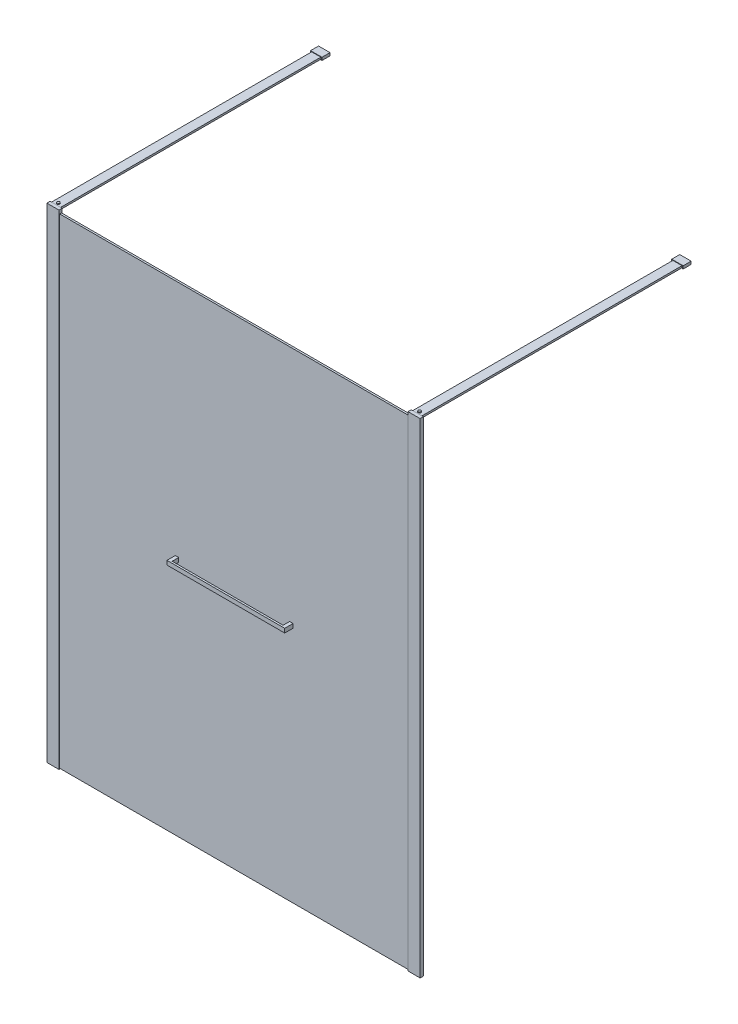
SolidWorks part; units mm, degrees
ref_plane "Płaszczyzna przednia" through (0, 0, 0) normal (0, 0, 1) x (1, 0, 0)
ref_plane "Płaszczyzna górna" through (0, 0, 0) normal (0, 1, 0) x (1, 0, 0)
ref_plane "Płaszczyzna prawa" through (0, 0, 0) normal (1, 0, 0) x (0, 0, -1)
sketch "Szkic1" plane through (0, 0, 0) normal (0, 1, 0) x (1, 0, 0)
  line L0 (0, 0) -> (0, 14)
  line L1 (0, 14) -> (53, 14)
  line L2 (53, 14) -> (53, 11)
  line L3 (53, 11) -> (42.9, 11)
  line L4 (42.9, 11) -> (42.9, 3)
  line L5 (42.9, 3) -> (53, 3)
  line L6 (53, 3) -> (53, 0)
  line L7 (53, 0) -> (0, 0)
  dimension "D1" = 53
  dimension "D2" = 14
  dimension "D3" = 10.1
  dimension "D5" = 8
extrude "Dodanie-wyciągnięcie1" add sketch "Szkic1" along normal blind 2100 from offset 3
sketch "Szkic2" plane through (0, 3, 0) normal (0, -1, 0) x (1, 0, 0)
  line L0 (42.9, -11) -> (53, -11) construction
  line L1 (42.9, -3) -> (1589.9, -3)
  line L2 (42.9, -3) -> (42.9, -11)
  line L3 (42.9, -11) -> (1589.9, -11)
  line L4 (1589.9, -3) -> (1589.9, -11)
  dimension "D1" = 1547
extrude "Dodanie-wyciągnięcie2" add sketch "Szkic2" against normal blind 2100 separate body
sketch "Szkic3" plane through (0, 3, 0) normal (0, -1, 0) x (1, 0, 0)
  line L0 (1579.8, -3) -> (1579.8, 0)
  line L1 (1589.9, -3) -> (42.9, -3) construction
  line L2 (1579.8, 0) -> (1632.8, 0)
  line L3 (1632.8, 0) -> (1632.8, -14)
  line L4 (1632.8, -14) -> (1579.8, -14)
  line L5 (1579.8, -14) -> (1579.8, -11)
  line L6 (1579.8, -11) -> (1589.9, -11)
  line L7 (1589.9, -11) -> (1589.9, -3)
  line L8 (1589.9, -3) -> (1579.8, -3)
  line L9 (42.9, -11) -> (1589.9, -11) construction
  line L10 (1589.9, -11) -> (1589.9, -3) construction
  dimension "D1" = 10.1
  dimension "D2" = 14
  dimension "D4" = 53
extrude "Dodanie-wyciągnięcie3" add sketch "Szkic3" against normal blind 2100 separate body
sketch "Szkic4" plane through (0, 2103, 0) normal (0, 1, 0) x (1, 0, 0)
  line L1 (0, 14) -> (53, 14)
  line L2 (0, 14) -> (0, 0)
  line L3 (0, 0) -> (53, 0)
  line L4 (53, 14) -> (53, 0)
extrude "Dodanie-wyciągnięcie4" add sketch "Szkic4" along normal blind 16
sketch "Szkic5" plane through (0, 2103, 0) normal (0, 1, 0) x (1, 0, 0)
  line L1 (1632.8, 14) -> (1579.8, 14)
  line L2 (1632.8, 14) -> (1632.8, 0)
  line L3 (1632.8, 0) -> (1579.8, 0)
  line L4 (1579.8, 14) -> (1579.8, 0)
extrude "Dodanie-wyciągnięcie5" add sketch "Szkic5" along normal blind 16
sketch "Szkic7" plane through (0, 3, 0) normal (0, -1, 0) x (1, 0, 0)
  line L1 (1579.8, 0) -> (1632.8, 0)
  line L2 (1579.8, 0) -> (1579.8, -14)
  line L3 (1579.8, -14) -> (1632.8, -14)
  line L4 (1632.8, 0) -> (1632.8, -14)
extrude "Dodanie-wyciągnięcie7" add sketch "Szkic7" along normal blind 3
sketch "Szkic8" plane through (0, 3, 0) normal (0, -1, 0) x (1, 0, 0)
  line L1 (0, 0) -> (53, 0)
  line L2 (0, 0) -> (0, -14)
  line L3 (0, -14) -> (53, -14)
  line L4 (53, 0) -> (53, -14)
extrude "Dodanie-wyciągnięcie8" add sketch "Szkic8" along normal blind 3
sketch "Szkic9" plane through (0, 0, -14) normal (0, 0, -1) x (-1, 0, 0)
  line L0 (-1632.8, 2119) -> (-1579.8, 2119) construction
  line L1 (-1626.3, 2119) -> (-1586.3, 2119)
  line L2 (-1626.3, 2119) -> (-1626.3, 2111)
  line L3 (-1626.3, 2111) -> (-1586.3, 2111)
  line L4 (-1586.3, 2119) -> (-1586.3, 2111)
  line L5 (-1632.8, 2119) -> (-1632.8, 0) construction
  line L6 (-1579.8, 2119) -> (-1579.8, 0) construction
  line L7 (-53, 2119) -> (-53, 0) construction
  line L8 (-46.5, 2119) -> (-6.5, 2119)
  line L9 (-46.5, 2119) -> (-46.5, 2111)
  line L10 (-46.5, 2111) -> (-6.5, 2111)
  line L11 (-6.5, 2119) -> (-6.5, 2111)
  line L12 (0, 2119) -> (0, 0) construction
  line L13 (-53, 2119) -> (0, 2119) construction
  dimension "D1" = 6.5
  dimension "D2" = 6.5
  dimension "D3" = 8
  dimension "D4" = 6.5
  dimension "D5" = 6.5
  dimension "D6" = 8
extrude "Dodanie-wyciągnięcie9" add sketch "Szkic9" along normal blind 1170 separate body
sketch "Szkic10" plane through (0, 0, -1184) normal (0, 0, -1) x (-1, 0, 0)
  line L0 (-1606.3, 2119) -> (-1606.3, 2115) construction
  line L1 (-1631.3, 2121.25) -> (-1581.3, 2121.25)
  line L2 (-1631.3, 2121.25) -> (-1631.3, 2108.75)
  line L3 (-1631.3, 2108.75) -> (-1581.3, 2108.75)
  line L4 (-1581.3, 2121.25) -> (-1581.3, 2108.75)
  line L5 (-1631.3, 2121.25) -> (-1581.3, 2108.75) construction
  line L6 (-1631.3, 2108.75) -> (-1581.3, 2121.25) construction
  line L7 (-1586.3, 2119) -> (-1626.3, 2119) construction
  line L8 (-1606.3, 2115) -> (-1626.3, 2115) construction
  line L9 (-1626.3, 2119) -> (-1626.3, 2111) construction
  line L10 (-26.5, 2119) -> (-26.5, 2115) construction
  line L11 (-51.5, 2121.25) -> (-1.5, 2121.25)
  line L12 (-51.5, 2121.25) -> (-51.5, 2108.75)
  line L13 (-51.5, 2108.75) -> (-1.5, 2108.75)
  line L14 (-1.5, 2121.25) -> (-1.5, 2108.75)
  line L15 (-51.5, 2121.25) -> (-1.5, 2108.75) construction
  line L16 (-51.5, 2108.75) -> (-1.5, 2121.25) construction
  line L17 (-6.5, 2119) -> (-46.5, 2119) construction
  line L18 (-26.5, 2115) -> (-46.5, 2115) construction
  line L19 (-46.5, 2119) -> (-46.5, 2111) construction
  point P0 (-1606.3, 2115)
  point P9 (-26.5, 2115)
  dimension "D1" = 12.5
  dimension "D2" = 50
  dimension "D3" = 12.5
  dimension "D4" = 50
extrude "Dodanie-wyciągnięcie10" add sketch "Szkic10" along normal blind 35 from offset 32
ref_plane "Płaszczyzna1" through (1606.3, 0, 0) normal (1, 0, 0) x (0, 0, -1)
sketch "Szkic11" plane through (1606.3, 0, 0) normal (1, 0, 0) x (0, 0, -1)
  line L0 (24, 2119) -> (24, 2127.4416) construction
  line L1 (24, 2119) -> (34.6926, 2119) construction
  line L2 (29.9, 2119) -> (29.65, 2122.8)
  line L3 (24, 2124.7) -> (30.2413, 2124.7) construction
  line L4 (24, 2124.7) -> (24, 2124.2)
  line L5 (1152, 2119) -> (14, 2119) construction
  line L6 (14, 2119) -> (14, 2111) construction
  line L7 (29.3989, 2119) -> (29.9, 2119)
  line L9 (29.1663, 2122.5357) -> (29.3989, 2119)
  arc A0 (24, 2124.7) -> (29.65, 2122.8) centre (24, 2115.3493) cw
  arc A1 (29.1663, 2122.5357) -> (24, 2124.2) centre (24, 2115.3493) ccw
  dimension "D1" = 0.5
  dimension "D2" = 11.3
  dimension "D3" = 5.7
  dimension "D4" = 3.8
  dimension "D5" = 11.8
  dimension "D6" = 0.5
  dimension "D7" = 10
revolve "Obrót1" add sketch "Szkic11" angle 360 about L0
ref_plane "Płaszczyzna2" through (26.5, 0, 0) normal (1, 0, 0) x (0, 0, -1)
sketch "Szkic14" plane through (26.5, 0, 0) normal (1, 0, 0) x (0, 0, -1)
  line L0 (24, 2119) -> (24, 2141.8878) construction
  line L1 (24, 2119) -> (23.0807, 2119) construction
  line L2 (29.9, 2119) -> (29.65, 2122.8)
  line L3 (24, 2124.7) -> (18.6294, 2124.7) construction
  line L4 (24, 2124.7) -> (24, 2124.2)
  line L5 (29.3989, 2119) -> (29.9, 2119)
  line L6 (29.1663, 2122.5357) -> (29.3989, 2119)
  line L7 (1152, 2119) -> (14, 2119) construction
  line L8 (14, 2119) -> (14, 2111) construction
  arc A0 (24, 2124.7) -> (29.65, 2122.8) centre (24, 2115.3493) cw
  arc A1 (29.1663, 2122.5357) -> (24, 2124.2) centre (24, 2115.3493) ccw
  dimension "D1" = 5.7
  dimension "D2" = 3.8
  dimension "D3" = 0.5
  dimension "D4" = 0.5
  dimension "D5" = 11.3
  dimension "D6" = 11.8
  dimension "D7" = 10
revolve "Obrót2" add sketch "Szkic14" angle 360 about L0
sketch "Szkic12" plane through (0, 0, -3) normal (0, 0, 1) x (1, 0, 0)
  line L0 (816.4, 1409.7928) -> (816.4, 762.3594) construction
  line L1 (566.4, 1053) -> (1066.4, 1053) construction
  line L2 (42.9, 2103) -> (42.9, 3) construction
  line L3 (1589.9, 2103) -> (1589.9, 3) construction
  line L5 (558.9, 1062) -> (573.9, 1062)
  line L6 (558.9, 1062) -> (558.9, 1044)
  line L7 (558.9, 1044) -> (573.9, 1044)
  line L8 (573.9, 1062) -> (573.9, 1044)
  line L9 (558.9, 1062) -> (573.9, 1044) construction
  line L10 (558.9, 1044) -> (573.9, 1062) construction
  line L11 (1058.9, 1062) -> (1073.9, 1062)
  line L12 (1058.9, 1062) -> (1058.9, 1044)
  line L13 (1058.9, 1044) -> (1073.9, 1044)
  line L14 (1073.9, 1062) -> (1073.9, 1044)
  line L15 (1058.9, 1062) -> (1073.9, 1044) construction
  line L16 (1058.9, 1044) -> (1073.9, 1062) construction
  dimension "D1" = 1053
  dimension "D2" = 500
  dimension "D3" = 15
  dimension "D4" = 18
extrude "Dodanie-wyciągnięcie11" add sketch "Szkic12" along normal blind 36.5 and the other way blind 18 separate body
sketch "Szkic13" plane through (573.9, 0, 0) normal (1, 0, 0) x (0, 0, -1)
  line L0 (21, 1044) -> (-33.5, 1044) construction
  line L1 (-33.5, 1062) -> (-25.5, 1062)
  line L2 (-33.5, 1062) -> (-33.5, 1044)
  line L3 (-33.5, 1044) -> (-25.5, 1044)
  line L4 (-25.5, 1062) -> (-25.5, 1044)
  dimension "D1" = 8
extrude "Dodanie-wyciągnięcie12" add sketch "Szkic13" along normal up to surface (485 mm away)
